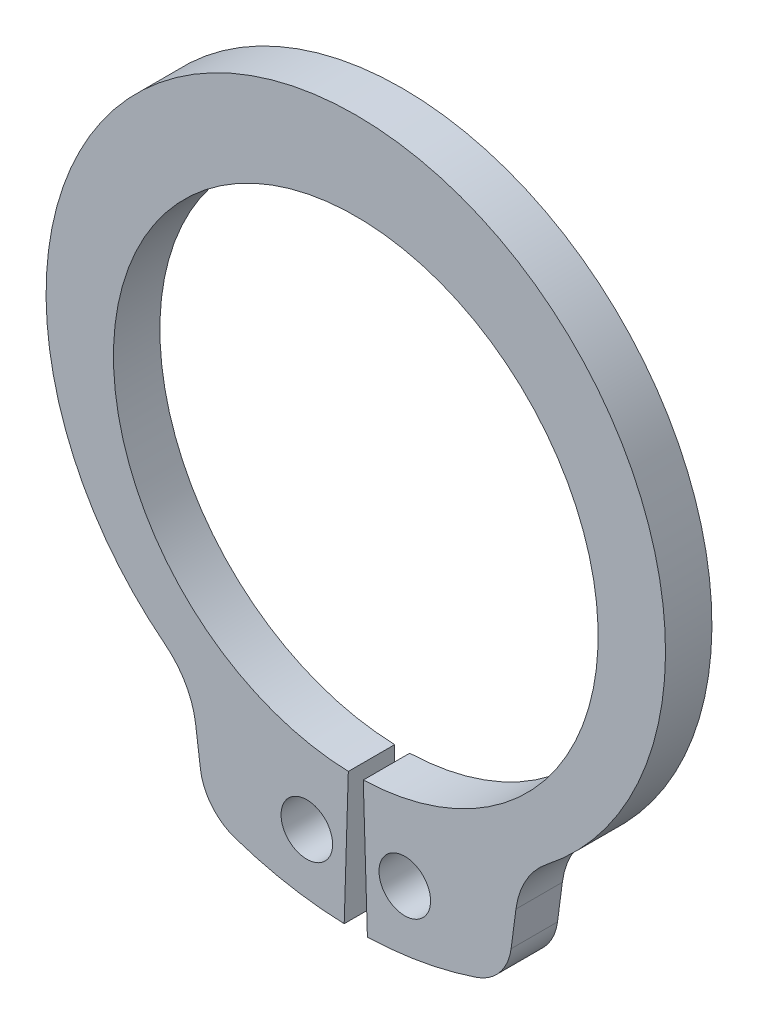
SolidWorks part; units mm, degrees
ref_plane "Plane1" through (0, 0, 0) normal (0, 0, 1) x (1, 0, 0)
ref_plane "Plane2" through (0, 0, 0) normal (0, 1, 0) x (1, 0, 0)
ref_plane "Plane3" through (0, 0, 0) normal (1, 0, 0) x (0, 0, -1)
sketch "Clipboard" plane through (0, 0, 0) normal (0, 0, 1) x (1, 0, 0)
  line L0 (0, 0) -> (1.7, 0)
  line L1 (0, 0) -> (0, 1)
  line L2 (0, 0) -> (0, -2.6)
  circle A0 centre (0, 0) radius 0.5
  circle A1 centre (0, 0) radius 5
  dimension "HoleDia" = 1
  dimension "ShaftDia" = 10
  dimension "LargeSection" = 1.7
  dimension "SmallSection" = 1
  dimension "LugSection" = 2.6
sketch "BodySke" plane through (0, 0, 0) normal (0, 0, 1) x (1, 0, 0)
  line L0 (-1.5431, 0) -> (1.5431, 0) construction
  line L1 (0, 0) -> (0, 6.4) construction
  line L2 (0.1449, -4.6978) -> (0.225, -7.2965)
  line L3 (-0.1449, -4.6978) -> (-0.225, -7.2965)
  line L4 (0, 0) -> (4.6911, -5.5931) construction
  line L5 (0, 0) -> (-4.6911, -5.5931) construction
  line L7 (3.1059, -5.3844) -> (3.012, -6.0977)
  line L8 (-3.1059, -5.3844) -> (-3.012, -6.0977)
  circle A0 centre (0, 0) radius 4.7 construction
  arc A1 (0.1449, -4.6978) -> (-0.1449, -4.6978) centre (0, 0) ccw
  arc A2 (3.6629, -4.3672) -> (-3.6629, -4.3672) centre (0, 0.3933) ccw construction
  arc A3 (0.225, -7.2965) -> (2.3413, -6.9143) centre (0, 0) ccw
  arc A4 (3.7049, -4.3346) -> (3.1059, -5.3844) centre (4.6911, -5.5931) ccw
  arc A5 (-3.1059, -5.3844) -> (-3.7049, -4.3346) centre (-4.6911, -5.5931) ccw
  arc A6 (-2.3413, -6.9143) -> (-0.225, -7.2965) centre (0, 0) ccw
  arc A7 (3.7049, -4.3346) -> (-3.7049, -4.3346) centre (0, 0.3933) ccw
  arc A8 (-3.1168, -5.3017) -> (3.1168, -5.3017) centre (0, 0) ccw construction
  circle A9 centre (0.95, -6.0762) radius 0.5
  circle A10 centre (-0.95, -6.0762) radius 0.5
  arc A11 (3.012, -6.0977) -> (2.3413, -6.9143) centre (2.0206, -5.9672) cw
  arc A12 (-3.012, -6.0977) -> (-2.3413, -6.9143) centre (-2.0206, -5.9672) ccw
  point P28 (2.9348, -6.6841)
  point P31 (-2.9348, -6.6841)
  dimension "GrooveDia" = 9.4
  dimension "D3" = 1
  dimension "LugRad" = 7.3
  dimension "HoleOffsetRad" = 6.15
  dimension "HoleDia" = 1
  dimension "D2" = 15
  dimension "LargeRad" = 6.4
  dimension "SmallRad" = 5.7
  dimension "Gap" = 0.45
  dimension "SmallAngle" = 79.975
  dimension "HoleSpacing" = 1.9
extrude "Body" add sketch "BodySke" against normal blind 0.9
sketch "NotSke" plane through (0, 0, 0) normal (0, 0, 1) x (1, 0, 0)
  line L0 (0.95, -5.5762) -> (0.95, -6.5762)
  line L1 (0.95, -6.5762) -> (-0.95, -6.5762)
  line L2 (-0.95, -6.5762) -> (-0.95, -5.5762)
  line L3 (-0.95, -5.5762) -> (0.95, -5.5762)
  circle A0 centre (0.95, -6.0762) radius 0.5 construction
  circle A1 centre (-0.95, -6.0762) radius 0.5 construction
extrude "Notch" [suppressed] cut sketch "NotSke" against normal through all
equation "' \"ShaftDia@Clipboard\" = 10"
equation "' \"Thickness@Body\" = 0.9"
equation "' \"GrooveDia@BodySke\" = 9.4"
equation "' \"LugSection@Clipboard\" = 2.6"
equation "' \"LargeSection@Clipboard\" = 1.7"
equation "' \"SmallSection@Clipboard\" = 1.0"
equation "' \"HoleDia@Clipboard\" = 1.0"
equation "' \"ShaftDia@Clipboard\" = 30"
equation "' \"Thickness@Body\" = 2.4"
equation "' \"GrooveDia@BodySke\" = 28.2"
equation "' \"LugSection@Clipboard\" = 5.6"
equation "' \"LargeSection@Clipboard\" = 4.5"
equation "' \"SmallSection@Clipboard\" = 2.5"
equation "' \"HoleDia@Clipboard\" = 2.3"
equation "\"Gap@BodySke\" =  \"Thickness@Body\" / 2"
equation "\"LargeRad@BodySke\" =  \"GrooveDia@BodySke\" / 2 +  \"LargeSection@Clipboard\""
equation "\"SmallRad@BodySke\" =  \"GrooveDia@BodySke\" / 2 +  \"SmallSection@Clipboard\""
equation "\"LugRad@BodySke\" = \"GrooveDia@BodySke\" / 2 + \"LugSection@Clipboard\""
equation "\"HoleOffsetRad@BodySke\" = (  \"ShaftDia@Clipboard\" / 2 + \"LugRad@BodySke\" ) / 2"
equation "\"HoleSpacing@BodySke\" = \"Gap@BodySke\"  * 2 +  \"HoleDia@Clipboard\""
equation "\"HoleDia@BodySke\" =  \"HoleDia@Clipboard\""
equation "\"SmallAngle@BodySke\" = atn(\"HoleSpacing@BodySke\" / 2 / sqr(\"HoleOffsetRad@BodySke\"  * \"HoleOffsetRad@BodySke\" - (\"HoleSpacing@BodySke\" / 2) * (\"HoleSpacing@BodySke\" / 2) ))  * 9 * ( 180 / 3.141593)"
